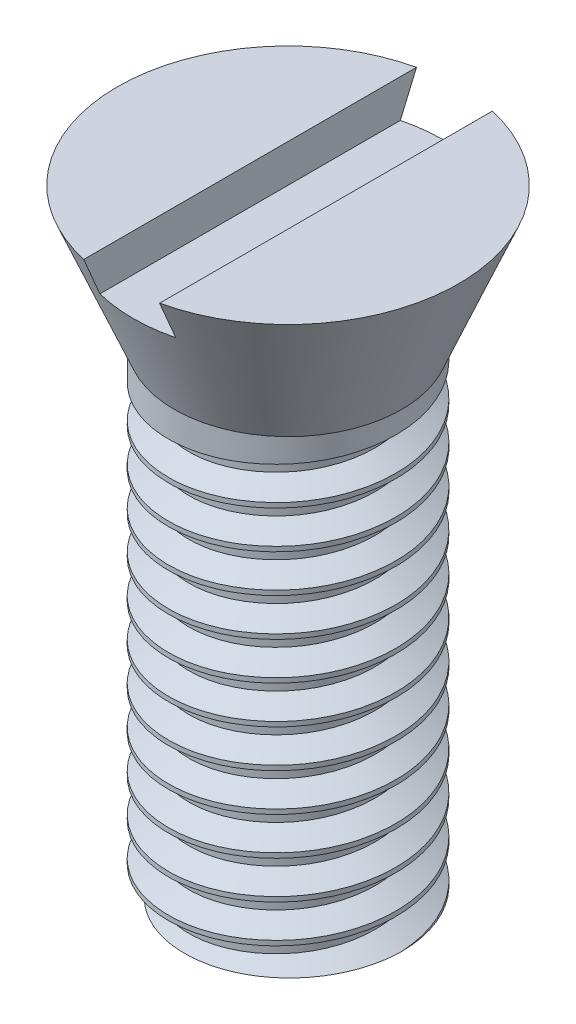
SolidWorks part; units mm, degrees
ref_plane "Front Plane" through (0, 0, 0) normal (0, 0, 1) x (1, 0, 0)
ref_plane "Top Plane" through (0, 0, 0) normal (0, 1, 0) x (1, 0, 0)
ref_plane "Right Plane" through (0, 0, 0) normal (1, 0, 0) x (0, 0, -1)
sketch "Sketch1" plane through (0, 0, 0) normal (0, 0, 1) x (1, 0, 0)
  line L0 (0, -6.1893) -> (0, 6.1893)
  line L1 (-3, 6.1893) -> (0, 6.1893) construction
  line L2 (-3, 6.1893) -> (-3, -6.1893)
  line L3 (-3, -6.1893) -> (0, -6.1893)
  line L4 (0, 6.1893) -> (0, 9.8107)
  line L5 (0, 9.8107) -> (-4.5, 9.8107)
  line L6 (-4.5, 9.8107) -> (-3, 6.1893)
  line L7 (-3, -6.1893) -> (0, -7.9214)
  line L8 (0, -7.9214) -> (0, -6.1893)
  point P3 (0, 0)
  dimension "D1" = 3
  dimension "D2" = 4.5
  dimension "D3" = 16
  dimension "D4" = 22.5
  dimension "D5" = 60
revolve "Revolve1" add sketch "Sketch1" angle 360 about L0
sketch "Sketch2" plane through (0, 0, 0) normal (0, 0, 1) x (1, 0, 0)
  line L0 (0, -4.95) -> (0, 4.95) construction
  line L1 (-1, 8.8107) -> (1, 8.8107)
  line L2 (-1, 8.8107) -> (-1, 9.8107)
  line L3 (-1, 9.8107) -> (1, 9.8107)
  line L4 (1, 8.8107) -> (1, 9.8107)
  line L6 (4.5, 9.8107) -> (-4.5, 9.8107) construction
  point P4 (0, 9.8107)
  dimension "D1" = 2
  dimension "D2" = 1
extrude "Cut-Extrude1" cut sketch "Sketch2" against normal through all both and the other way through all
thread "Thread3" pitch 1 start angle 0, offset 0, length 0, pitch 1, diameter 6
ref_plane "Plane3" through (-3, 6.1893, 0) normal (0, 0, 1) x (-1, 0, 0)
sketch "Thread Profile3" plane through (-3, 6.1893, 0) normal (0, 0, 1) x (-1, 0, 0)
  line L0 (0, 0) -> (0, 1) construction
  line L11 (0, 0) -> (0, 0.875)
  line L12 (0, 0.875) -> (-0.5413, 0.5625)
  line L13 (-0.5413, 0.5625) -> (-0.5413, 0.3125)
  line L15 (-0.5413, 0.3125) -> (0, 0)
  line L17 (-0.5413, 0.4375) -> (0, 0.4375) construction
  point P2 (0, 0)
  dimension "Pitch" = 1
  dimension "Profile_Angle" = 60
  dimension "Profile_Land" = 0.25
  dimension "Profile_Height" = 0.5413
